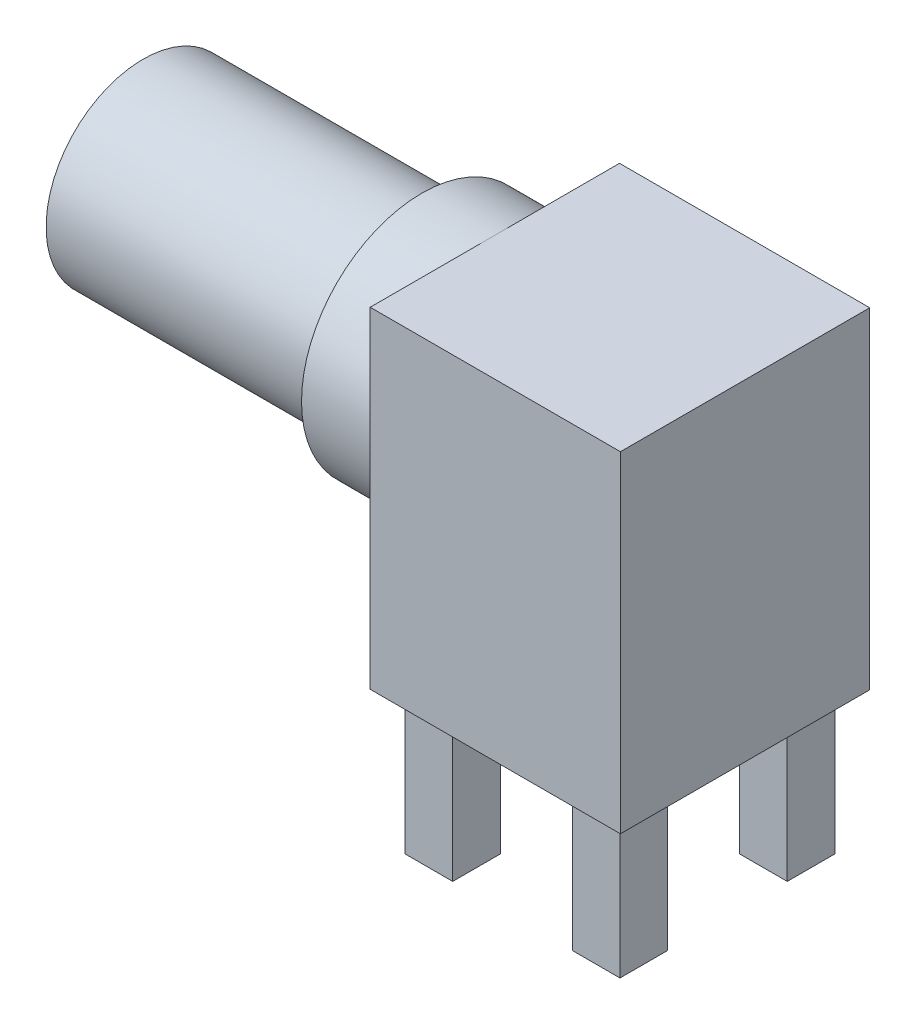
SolidWorks part; units mm, degrees
ref_plane "Front Plane" through (0, 0, 0) normal (0, 0, 1) x (1, 0, 0)
ref_plane "Top Plane" through (0, 0, 0) normal (0, 1, 0) x (1, 0, 0)
ref_plane "Right Plane" through (0, 0, 0) normal (1, 0, 0) x (0, 0, -1)
sketch "Sketch1" plane through (0, 0, 0) normal (0, 0, 1) x (1, 0, 0)
  line L1 (-3.5052, -4.6355) -> (3.5052, -4.6355)
  line L2 (-3.5052, -4.6355) -> (-3.5052, 4.6355)
  line L3 (-3.5052, 4.6355) -> (3.5052, 4.6355)
  line L4 (3.5052, -4.6355) -> (3.5052, 4.6355)
  line L5 (-3.5052, -4.6355) -> (3.5052, 4.6355) construction
  line L6 (-3.5052, 4.6355) -> (3.5052, -4.6355) construction
  point P0 (0, 0)
  dimension "D1" = 7.0104
  dimension "D2" = 9.271
extrude "Boss-Extrude1" add sketch "Sketch1" along normal mid plane 6.985
sketch "Sketch2" plane through (-3.5052, 0, 0) normal (-1, 0, 0) x (0, 0, 1)
  line L0 (0, 4.6355) -> (0, 1.2637) construction
  line L1 (3.4925, 4.6355) -> (-3.4925, 4.6355) construction
  circle A0 centre (0, 1.2637) radius 3.3719
  dimension "D1" = 6.7437
extrude "Boss-Extrude2" add sketch "Sketch2" along normal blind 2.0447
sketch "Sketch3" plane through (-5.5499, 0, 0) normal (-1, 0, 0) x (0, 0, 1)
  circle A0 centre (0, 1.2637) radius 2.7178
  dimension "D1" = 5.4356
extrude "Boss-Extrude3" add sketch "Sketch3" along normal blind 7.8105
sketch "Sketch4" plane through (-13.3604, 0, 0) normal (-1, 0, 0) x (0, 0, 1)
  circle A0 centre (0, 1.2637) radius 0.637
  circle A1 centre (0, 1.2637) radius 2.1925
  dimension "D1" = 4.3851
  dimension "D2" = 1.2739
extrude "Cut-Extrude1" cut sketch "Sketch4" against normal blind 3.175
sketch "Sketch5" plane through (0, -4.6355, 0) normal (0, -1, 0) x (1, 0, 0)
  line L1 (-2.3432, -2.3432) -> (2.3431, -2.3432) construction
  line L2 (-2.3432, -2.3432) -> (-2.3432, 2.3432) construction
  line L3 (-2.3432, 2.3432) -> (2.3431, 2.3432) construction
  line L4 (2.3431, -2.3432) -> (2.3431, 2.3432) construction
  line L5 (-2.3432, -2.3432) -> (2.3431, 2.3432) construction
  line L6 (-2.3432, 2.3432) -> (2.3431, -2.3432) construction
  line L9 (-3.0099, 1.6764) -> (-1.6764, 1.6764)
  line L10 (-3.0099, 1.6764) -> (-3.0099, 3.0099)
  line L11 (-3.0099, 3.0099) -> (-1.6764, 3.0099)
  line L12 (-1.6764, 1.6764) -> (-1.6764, 3.0099)
  line L13 (-3.0099, 1.6764) -> (-1.6764, 3.0099) construction
  line L14 (-3.0099, 3.0099) -> (-1.6764, 1.6764) construction
  line L15 (3.0099, 1.6764) -> (1.6764, 1.6764)
  line L16 (3.0099, 1.6764) -> (3.0099, 3.0099)
  line L17 (3.0099, 3.0099) -> (1.6764, 3.0099)
  line L18 (1.6764, 1.6764) -> (1.6764, 3.0099)
  line L19 (3.0099, 1.6764) -> (1.6764, 3.0099) construction
  line L20 (3.0099, 3.0099) -> (1.6764, 1.6764) construction
  line L21 (1.6764, -1.6764) -> (3.0099, -1.6764)
  line L22 (1.6764, -1.6764) -> (1.6764, -3.0099)
  line L23 (1.6764, -3.0099) -> (3.0099, -3.0099)
  line L24 (3.0099, -1.6764) -> (3.0099, -3.0099)
  line L25 (1.6764, -1.6764) -> (3.0099, -3.0099) construction
  line L26 (1.6764, -3.0099) -> (3.0099, -1.6764) construction
  line L27 (-3.0099, -1.6764) -> (-1.6764, -1.6764)
  line L28 (-3.0099, -1.6764) -> (-3.0099, -3.0099)
  line L29 (-3.0099, -3.0099) -> (-1.6764, -3.0099)
  line L30 (-1.6764, -1.6764) -> (-1.6764, -3.0099)
  line L31 (-3.0099, -1.6764) -> (-1.6764, -3.0099) construction
  line L32 (-3.0099, -3.0099) -> (-1.6764, -1.6764) construction
  circle A4 centre (0, 0) radius 0.7874
  point P0 (0, 0)
  dimension "D4" = 1.5748
  dimension "D1" = 4.6863
  dimension "D2" = 4.6863
  dimension "D3" = 1.3335
extrude "Boss-Extrude4" add sketch "Sketch5" along normal blind 3.9878
sketch "Sketch6" plane through (0, -4.6355, 0) normal (0, -1, 0) x (1, 0, 0)
  circle A0 centre (0, 0) radius 1.27
  circle A1 centre (0, 0) radius 0.7874 construction
  circle A2 centre (0, 0) radius 0.7874
  dimension "D1" = 2.54
extrude "Cut-Extrude2" cut sketch "Sketch6" against normal blind 0.127
